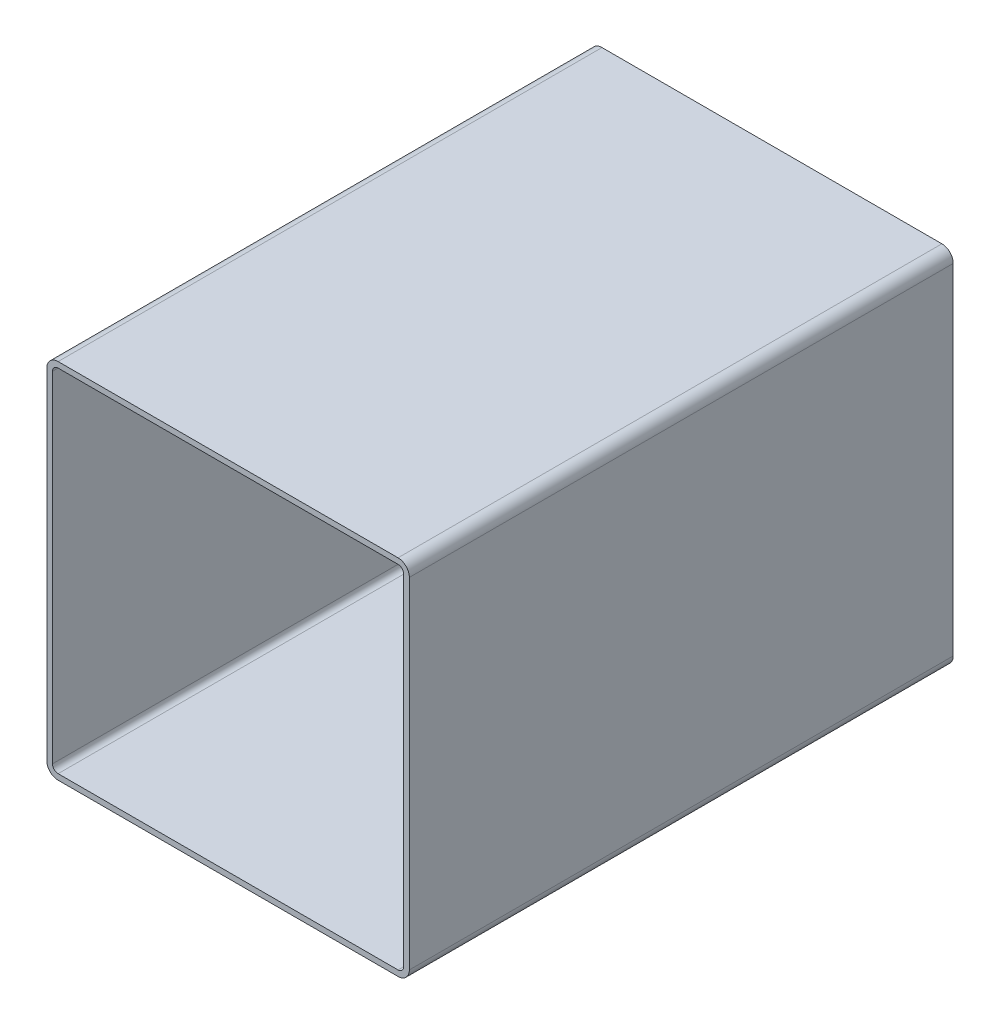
SolidWorks part; units mm, degrees
ref_plane "Front Plane" through (0, 0, 0) normal (0, 0, 1) x (1, 0, 0)
ref_plane "Top Plane" through (0, 0, 0) normal (0, 1, 0) x (1, 0, 0)
ref_plane "Right Plane" through (0, 0, 0) normal (1, 0, 0) x (0, 0, -1)
sketch "Sketch1" plane through (0, 0, 0) normal (0, 0, 1) x (1, 0, 0)
sketch_block_instance "HSS8x8x0.125-1"
sketch_block "HSS8x8x0.125"
extrude "Boss-Extrude1" add sketch "Sketch1" along normal blind 304.8
